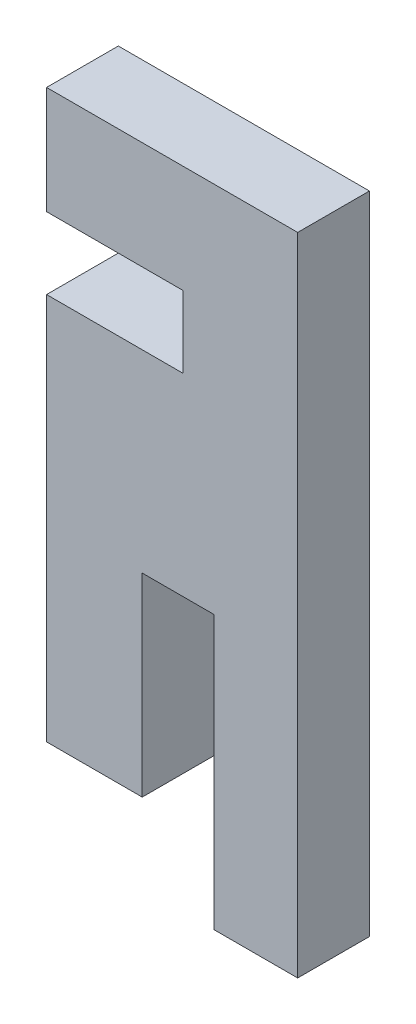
SolidWorks part; units mm, degrees
ref_plane "Alzado" through (0, 0, 0) normal (0, 0, 1) x (1, 0, 0)
ref_plane "Planta" through (0, 0, 0) normal (0, 1, 0) x (1, 0, 0)
ref_plane "Vista lateral" through (0, 0, 0) normal (1, 0, 0) x (0, 0, -1)
sketch "Sketch1" plane through (0, 0, 0) normal (0, 0, 1) x (1, 0, 0)
  line L0 (-5.25, 6) -> (-5.25, -10.2)
  line L1 (1.75, -13.5) -> (5.25, -13.5)
  line L2 (-5.25, -10.2) -> (-5.25, 6)
  line L3 (-5.25, 13.5) -> (5.25, 13.5)
  line L4 (5.25, -13.5) -> (5.25, 13.5)
  line L5 (-3.9667, -10.2) -> (5.25, 13.5) construction
  line L6 (-5.25, 13.5) -> (5.25, -13.5) construction
  line L7 (-5.25, 9) -> (0.45, 9)
  line L9 (-5.25, 6) -> (0.45, 6)
  line L10 (0.45, 9) -> (0.45, 6)
  line L11 (-5.25, -10.2) -> (-1.25, -10.2)
  line L12 (1.75, -13.5) -> (1.75, -2.0856)
  line L13 (1.75, -2.0856) -> (-1.25, -2.0856)
  line L14 (-1.25, -2.0856) -> (-1.25, -10.2)
  line L15 (-5.25, 9) -> (-5.25, 13.5)
  point P0 (0, 0)
  dimension "D1" = 27
  dimension "D2" = 10.5
  dimension "D3" = 3
  dimension "D4" = 4.5
  dimension "D5" = 5.7
  dimension "D6" = 16.2
  dimension "D7" = 3
  dimension "D8" = 4
  dimension "D9" = 15.5856
extrude "Boss-Extrude1" add sketch "Sketch1" along normal blind 3 contours L15 L7 L10 L9 L0 L11 L14 L13 L12 L1 L4 L3
